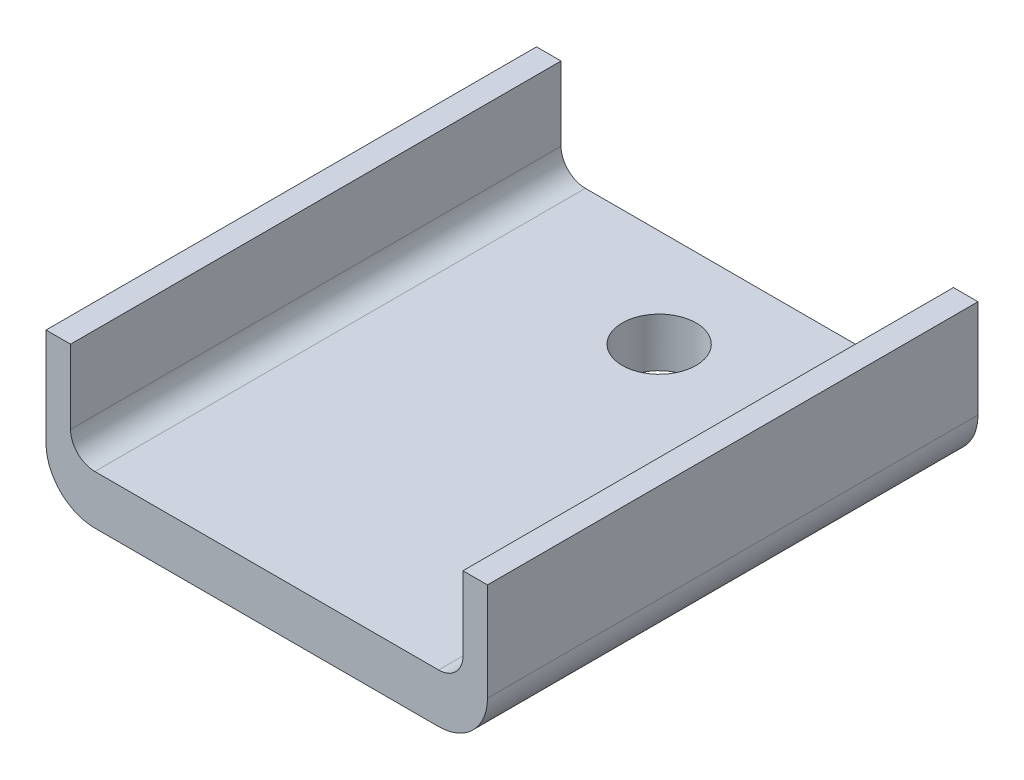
SolidWorks part; units mm, degrees
ref_plane "Front Plane" through (0, 0, 0) normal (0, 0, 1) x (1, 0, 0)
ref_plane "Top Plane" through (0, 0, 0) normal (0, 1, 0) x (1, 0, 0)
ref_plane "Right Plane" through (0, 0, 0) normal (1, 0, 0) x (0, 0, -1)
sketch "Sketch1" plane through (0, 0, 0) normal (0, 0, 1) x (1, 0, 0)
  line L0 (0, 0) -> (12.7, 0)
  line L1 (12.7, 0) -> (12.7, 6.35)
  line L2 (12.7, 6.35) -> (14.2875, 6.35)
  line L3 (14.2875, 6.35) -> (14.2875, -3.175)
  line L4 (14.2875, -3.175) -> (-14.2875, -3.175)
  line L5 (-14.2875, -3.175) -> (-14.2875, 6.35)
  line L6 (-14.2875, 6.35) -> (-12.7, 6.35)
  line L7 (-12.7, 6.35) -> (-12.7, 0)
  line L8 (-12.7, 0) -> (0, 0)
  dimension "D1" = 3.175
  dimension "D2" = 9.525
  dimension "D3" = 28.575
  dimension "D4" = 25.4
  dimension "D5" = 6.35
extrude "Boss-Extrude1" add sketch "Sketch1" along normal mid plane 31.75
sketch "Sketch2" plane through (0, 0, 0) normal (0, 1, 0) x (1, 0, 0)
  line L0 (12.7, -15.875) -> (-12.7, -15.875) construction
  circle A0 centre (0, 9.525) radius 2.3876
  dimension "D1" = 25.4
  dimension "D2" = 4.7752
extrude "Cut-Extrude1" cut sketch "Sketch2" against normal blind 12.7
fillet "Fillet1" radius 3.175 2 edges at (-14.2875, -3.175, 0) (14.2875, -3.175, 0)
fillet "Fillet2" radius 1.5748 2 edges at (12.7, 0, 0) (-12.7, 0, 0)
